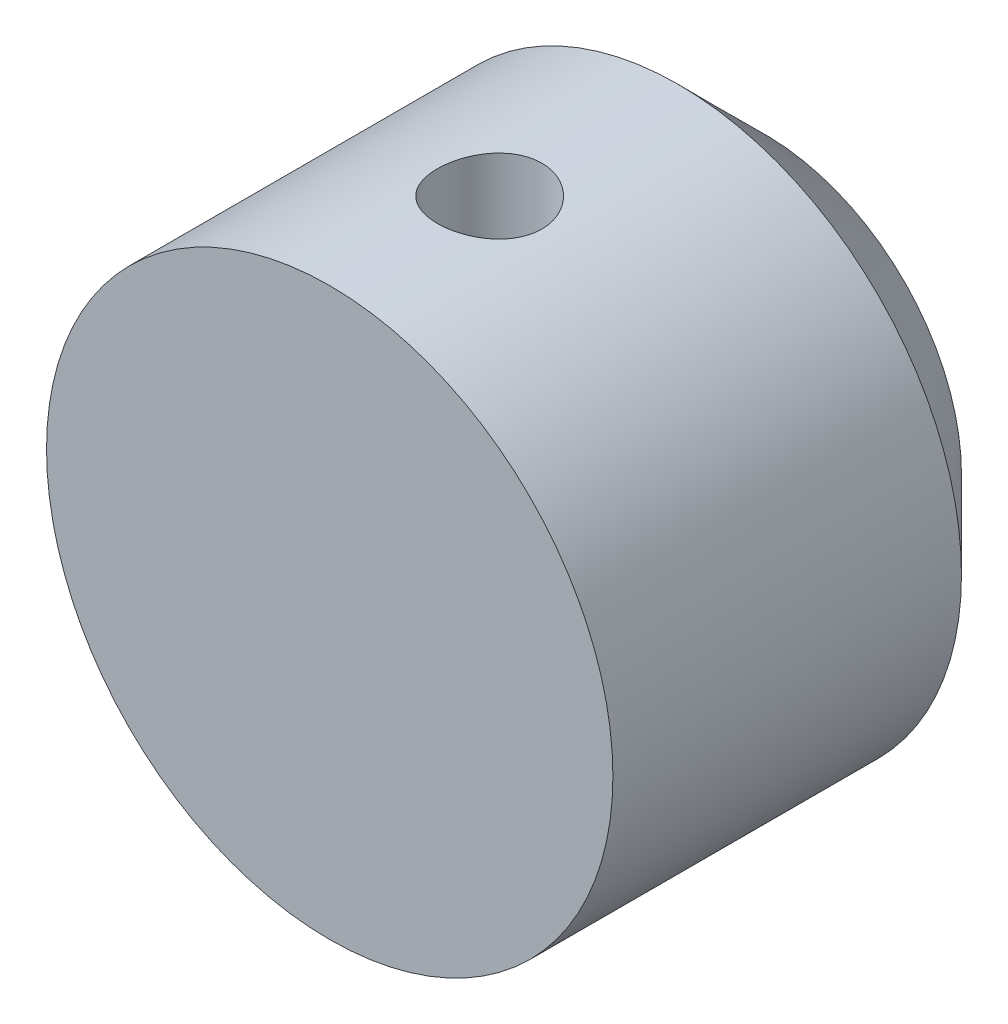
SolidWorks part; units mm, degrees
ref_plane "前视基准面" through (0, 0, 0) normal (0, 0, 1) x (1, 0, 0)
ref_plane "上视基准面" through (0, 0, 0) normal (0, 1, 0) x (1, 0, 0)
ref_plane "右视基准面" through (0, 0, 0) normal (1, 0, 0) x (0, 0, -1)
sketch "草图1" plane through (0, 0, 0) normal (0, 0, 1) x (1, 0, 0)
  circle A0 centre (0, 0) radius 32.5
  dimension "D1" = 65
extrude "凸台-拉伸1" add sketch "草图1" along normal blind 50
sketch "草图2" plane through (0, 0, 0) normal (0, 1, 0) x (1, 0, 0)
  circle A0 centre (0, -31.6507) radius 6
  dimension "D1" = 12
extrude "切除-拉伸1" cut sketch "草图2" against normal through all and the other way through all
chamfer "倒角3" distance 10 angle 45 1 edges at (32.5, 0, 0)
